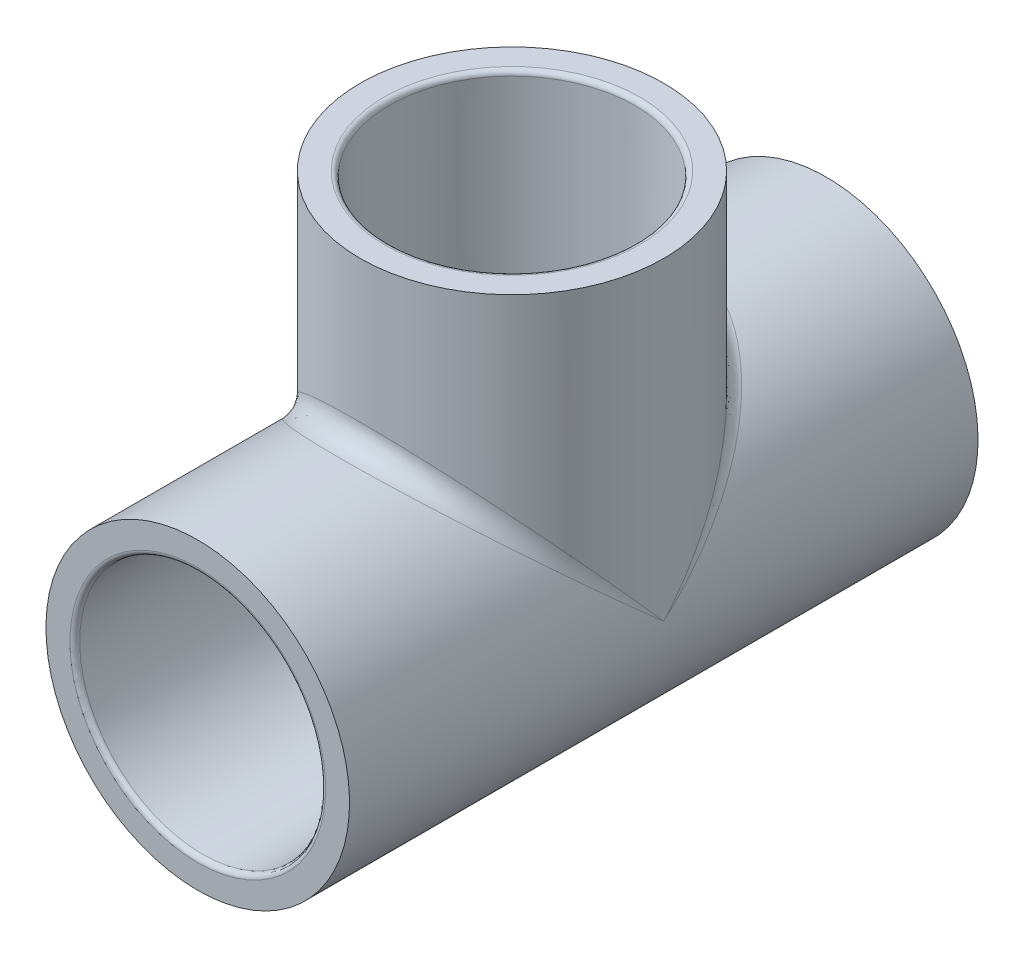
SolidWorks part; units mm, degrees
ref_plane "Front Plane" through (0, 0, 0) normal (0, 0, 1) x (1, 0, 0)
ref_plane "Top Plane" through (0, 0, 0) normal (0, 1, 0) x (1, 0, 0)
ref_plane "Right Plane" through (0, 0, 0) normal (1, 0, 0) x (0, 0, -1)
sketch "Sketch1" plane through (0, 0, 0) normal (1, 0, 0) x (0, 0, -1)
  line L0 (-34.3408, 0) -> (34.3408, 0) construction
  line L1 (-34.3408, 0) -> (-34.3408, -16.5862)
  line L2 (-34.3408, -16.5862) -> (34.3408, -16.5862)
  line L3 (34.3408, -16.5862) -> (34.3408, 0)
  line L4 (-34.3408, -13.4366) -> (-14.3002, -13.2842)
  line L5 (-14.3002, -13.2842) -> (-14.3002, -12.2936)
  line L6 (-14.3002, -12.2936) -> (0, -12.2936)
  line L7 (0, -12.2936) -> (0, 0)
  line L8 (0, -12.2936) -> (0, -16.5862) construction
  point P2 (0, 0)
sketch "Sketch2" plane through (0, 0, 0) normal (1, 0, 0) x (0, 0, -1)
  line L0 (0, 0) -> (0, 34.3408) construction
  line L1 (0, 34.3408) -> (16.5862, 34.3408)
  line L2 (16.5862, 34.3408) -> (16.5862, 0)
  line L3 (-34.3408, 0) -> (34.3408, 0) construction
  line L4 (16.5862, 0) -> (0, 0)
  line L5 (13.4366, 34.3408) -> (13.2842, 14.3002)
  line L6 (13.2842, 14.3002) -> (12.2936, 14.3002)
  line L7 (12.2936, 14.3002) -> (12.2936, 0)
  line L8 (-14.3002, -12.2936) -> (0, -12.2936) construction
sketch "Sketch3" plane through (0, 0, 0) normal (1, 0, 0) x (0, 0, -1)
  line L1 (-34.3408, 0) -> (34.3408, 0)
  line L2 (-34.3408, 0) -> (-34.3408, -16.5862)
  line L3 (-34.3408, -16.5862) -> (34.3408, -16.5862)
  line L4 (34.3408, 0) -> (34.3408, -16.5862)
revolve "Revolve1" add sketch "Sketch3" angle 360 about L1
sketch "Sketch4" plane through (0, 0, 0) normal (1, 0, 0) x (0, 0, -1)
  line L1 (0, 34.3408) -> (16.5862, 34.3408)
  line L2 (0, 34.3408) -> (0, 0)
  line L3 (0, 0) -> (16.5862, 0)
  line L4 (16.5862, 34.3408) -> (16.5862, 0)
revolve "Revolve2" add sketch "Sketch4" angle 360 about L2
sketch "Sketch5" plane through (0, 0, 0) normal (1, 0, 0) x (0, 0, -1)
  line L0 (-14.3002, -12.2936) -> (0, -12.2936) construction
  line L1 (-14.3002, -13.2842) -> (-14.3002, -12.2936) construction
  line L2 (-34.3408, -13.4366) -> (-14.3002, -13.2842) construction
  line L3 (-14.3002, -12.2936) -> (14.3002, -12.2936)
  line L4 (-14.3002, -13.2842) -> (-14.3002, -12.2936)
  line L5 (-34.3408, -13.4366) -> (-14.3002, -13.2842)
  line L6 (-34.3408, -13.4366) -> (-34.3408, 0)
  line L7 (-34.3408, 0) -> (34.3408, 0)
  line L8 (0, 0) -> (0, -12.2936) construction
  line L9 (14.3002, -13.2842) -> (14.3002, -12.2936)
  line L10 (34.3408, -13.4366) -> (14.3002, -13.2842)
  line L11 (34.3408, -13.4366) -> (34.3408, 0)
revolve "Cut-Revolve1" cut sketch "Sketch5" angle 360 about L7
sketch "Sketch6" plane through (0, 0, 0) normal (1, 0, 0) x (0, 0, -1)
  line L0 (12.2936, 0) -> (12.2936, 14.3002)
  line L1 (12.2936, 14.3002) -> (13.2842, 14.3002)
  line L2 (13.4366, 34.3408) -> (13.2842, 14.3002) construction
  line L3 (13.4366, 34.3408) -> (13.2842, 14.3002)
  line L4 (0, 0) -> (0, 34.3408) construction
  line L5 (0, 0) -> (0, 34.3408)
  line L6 (0, 34.3408) -> (13.4366, 34.3408)
  line L7 (0, 0) -> (12.2936, 0)
revolve "Cut-Revolve2" cut sketch "Sketch6" angle 360 about L5
fillet "Fillet1" radius 0.2477 3 edges at (0, -13.2842, -14.3002) (0, 14.3002, -13.2842) (0, -13.2842, 14.3002)
fillet "Fillet2" radius 0.5375 3 edges at (0, -13.4366, -34.3408) (0, 34.3408, -13.4366) (0, -13.4366, 34.3408)
fillet "Fillet3" radius 2.2517 2 edges at (0, 16.5862, 16.5862) (0, 16.5862, -16.5862)
sketch "Sketch7" plane through (0, 0, 0) normal (1, 0, 0) x (0, 0, -1)
  line L0 (-14.3002, -12.2936) -> (0, -12.2936) construction
  line L1 (-14.3002, -13.2842) -> (-14.3002, -12.2936) construction
  line L2 (-34.3408, -13.4366) -> (-14.3002, -13.2842) construction
  line L3 (-14.3002, -12.2936) -> (14.3002, -12.2936)
  line L4 (-14.3002, -13.2842) -> (-14.3002, -12.2936)
  line L5 (-34.3408, -13.4366) -> (-14.3002, -13.2842)
  line L6 (0, 0) -> (0, -12.2936) construction
  line L7 (0, 0) -> (-34.3408, 0) construction
  line L8 (-14.3002, 12.2936) -> (-12.2936, 12.2936)
  line L9 (-14.3002, 13.2842) -> (-14.3002, 12.2936)
  line L10 (-34.3408, 13.4366) -> (-14.3002, 13.2842)
  line L11 (13.4366, 34.3408) -> (13.2842, 14.3002) construction
  line L12 (13.2842, 14.3002) -> (12.2936, 14.3002) construction
  line L13 (12.2936, 14.3002) -> (12.2936, 0) construction
  line L14 (13.4366, 34.3408) -> (13.2842, 14.3002)
  line L15 (13.2842, 14.3002) -> (12.2936, 14.3002)
  line L16 (12.2936, 14.3002) -> (12.2936, 12.2936)
  line L17 (-12.2936, 14.3002) -> (-12.2936, 12.2936)
  line L18 (-13.2842, 14.3002) -> (-12.2936, 14.3002)
  line L19 (-13.4366, 34.3408) -> (-13.2842, 14.3002)
  line L20 (14.3002, -13.2842) -> (14.3002, -12.2936)
  line L21 (34.3408, -13.4366) -> (14.3002, -13.2842)
  line L22 (14.3002, 13.2842) -> (14.3002, 12.2936)
  line L23 (34.3408, 13.4366) -> (14.3002, 13.2842)
  line L24 (12.2936, 12.2936) -> (14.3002, 12.2936)
  point P24 (0, 12.2936)
  point P29 (-34.3408, -13.4366)
equation "\"D1@Sketch2\"=\"Diameter 1@Sketch1\""
equation "\"D2@Sketch2\"=\"Diameter 2@Sketch1\""
equation "\"D3@Sketch2\"=\"Socket Depth@Sketch1\""
equation "\"D1@Fillet1\"=0.25*(\"Diameter 2@Sketch1\"-\"Diameter 3@Sketch2\")*0.5"
equation "\"D1@Fillet2\"=.02*\"Diameter 1@Sketch1\""
equation "\"D1@Fillet3\"=.075*(\"Diameter 1@Sketch1\"+\"Wall 1@Sketch1\")"
